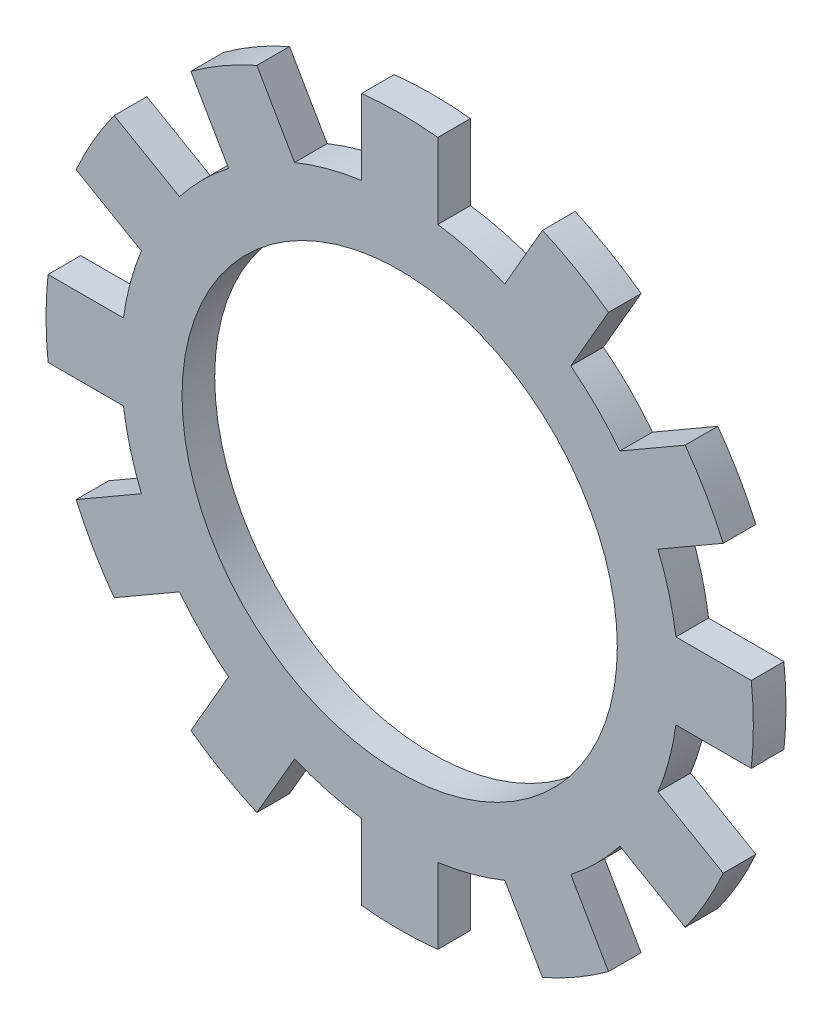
SolidWorks part; units mm, degrees
ref_plane "Front Plane" through (0, 0, 0) normal (0, 0, 1) x (1, 0, 0)
ref_plane "Top Plane" through (0, 0, 0) normal (0, 1, 0) x (1, 0, 0)
ref_plane "Right Plane" through (0, 0, 0) normal (1, 0, 0) x (0, 0, -1)
sketch "Sketch1" plane through (0, 0, 0) normal (0, 0, 1) x (1, 0, 0)
  circle A0 centre (0, 0) radius 8
  circle A1 centre (0, 0) radius 10.25
  dimension "D1" = 16
  dimension "D2" = 20.5
extrude "Boss-Extrude1" add sketch "Sketch1" along normal mid plane 1.2
sketch "Sketch2" plane through (0, 0, 0) normal (0, 0, 1) x (1, 0, 0)
  line L0 (0, 2.6811) -> (0, -2.8425) construction
sketch "Sketch3" plane through (0, 0, 0) normal (0, 0, 1) x (1, 0, 0)
  line L0 (-1.4, 12.9244) -> (-1.4, 10.1539)
  line L2 (0, 2.6811) -> (0, -2.8425) construction
  line L3 (0, 10.25) -> (0, 13)
  arc A0 (0, 13) -> (-1.4, 12.9244) centre (0, 0) ccw
  arc A1 (0, 10.25) -> (-1.4, 10.1539) centre (0, 0) ccw
  circle A2 centre (0, 0) radius 10.25 construction
  dimension "D2" = 13
  dimension "D1" = 1.4
extrude "Boss-Extrude2" add sketch "Sketch3" along normal mid plane 1.2
mirror "Mirror1" about plane through (0, 0, 0) normal (1, 0, 0) of "Boss-Extrude2"
pattern_circular "CirPattern2" count 12 over 360 about axis through (0, 0, 0) along (0, 0, 1) of "Boss-Extrude2", "Mirror1"
